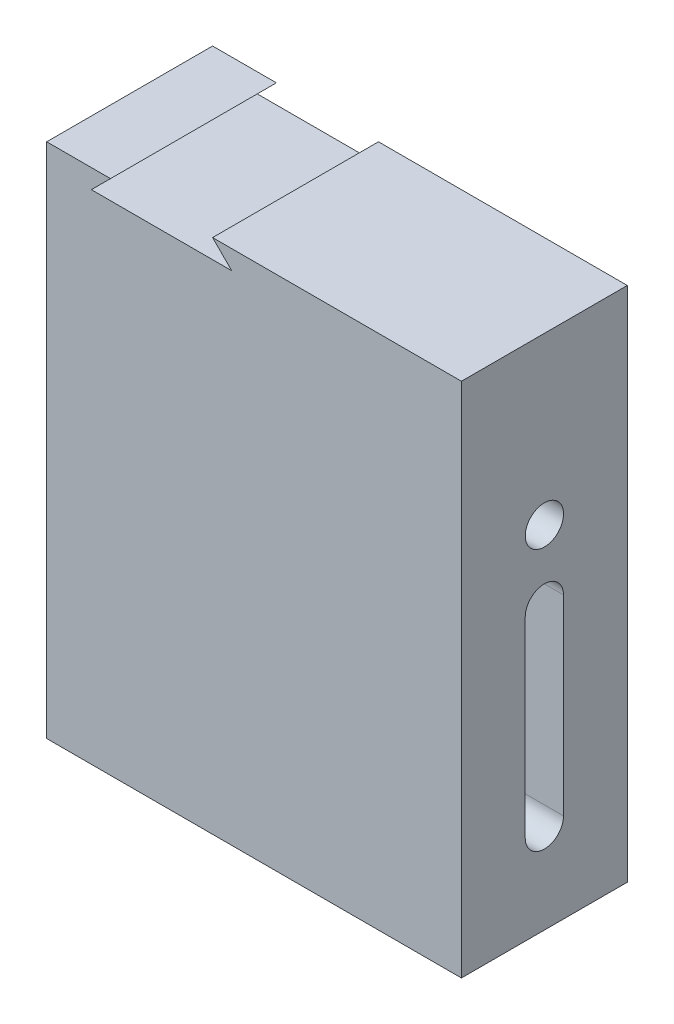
SolidWorks part; units mm, degrees
ref_plane "Face" through (0, 0, 0) normal (0, 0, 1) x (1, 0, 0)
ref_plane "Dessus" through (0, 0, 0) normal (0, 1, 0) x (1, 0, 0)
ref_plane "Droite" through (0, 0, 0) normal (1, 0, 0) x (0, 0, -1)
sketch "Esquisse1" plane through (0, 0, 0) normal (0, 0, 1) x (1, 0, 0)
  line L1 (0, 0) -> (65, 0)
  line L2 (0, 0) -> (0, 81)
  line L3 (0, 81) -> (65, 81)
  line L4 (65, 0) -> (65, 81)
  dimension "D1" = 65
  dimension "D2" = 81
extrude "Base-Extrusion" add sketch "Esquisse1" along normal blind 26
sketch "Esquisse2" plane through (65, 0, 0) normal (1, 0, 0) x (0, 0, -1)
  line L0 (-13, 81) -> (-13, -3.9857) construction
  line L1 (-26, 81) -> (0, 81) construction
  circle A0 centre (-13, 55) radius 3
  dimension "D1" = 6
  dimension "D2" = 26
extrude "Enlèv. mat.-Extru.1" cut sketch "Esquisse2" against normal blind 15
sketch "Esquisse3" plane through (65, 0, 0) normal (1, 0, 0) x (0, 0, -1)
  line L0 (-13, 81) -> (-13, 0) construction
  line L1 (-26, 81) -> (0, 81) construction
  line L2 (-26, 0) -> (0, 0) construction
  line L5 (-16, 44) -> (-16, 14)
  line L7 (-10, 44) -> (-10, 14)
  arc A0 (-16, 44) -> (-10, 44) centre (-13, 44) cw
  arc A1 (-16, 14) -> (-10, 14) centre (-13, 14) ccw
  circle A2 centre (-13, 55) radius 3 construction
  dimension "D1" = 3
  dimension "D2" = 30
  dimension "D3" = 11
extrude "Enlèv. mat.-Extru.2" cut sketch "Esquisse3" against normal blind 14
sketch "Esquisse4" plane through (0, 0, 26) normal (0, 0, 1) x (1, 0, 0)
  line L0 (10, 81) -> (26, 81)
  line L1 (65, 81) -> (0, 81) construction
  line L2 (26, 81) -> (29, 78)
  line L3 (29, 78) -> (7, 78)
  line L4 (7, 78) -> (10, 81)
  line L5 (18, 81) -> (18, 64.8) construction
  line L6 (0, 81) -> (0, 0) construction
  dimension "D1" = 18
  dimension "D2" = 3
  dimension "D3" = 45
  dimension "D4" = 16
extrude "Enlèv. mat.-Extru.3" cut sketch "Esquisse4" against normal through all
